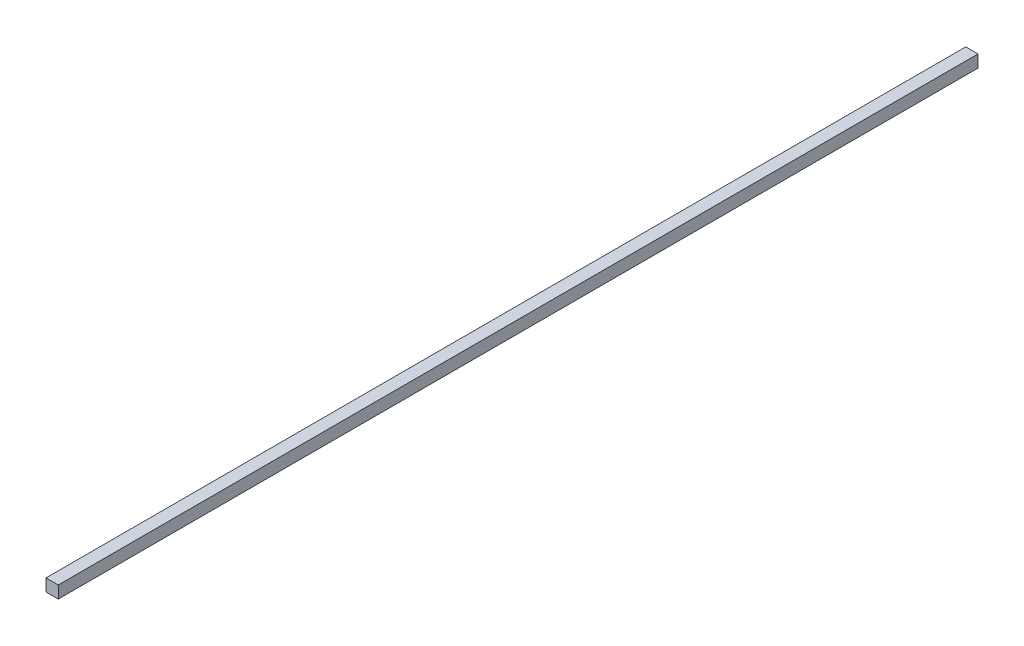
SolidWorks part; units mm, degrees
ref_plane "Plan de face" through (0, 0, 0) normal (0, 0, 1) x (1, 0, 0)
ref_plane "Plan de dessus" through (0, 0, 0) normal (0, 1, 0) x (1, 0, 0)
ref_plane "Plan de droite" through (0, 0, 0) normal (1, 0, 0) x (0, 0, -1)
sketch "Esquisse1" plane through (0, 0, 0) normal (0, 0, 1) x (1, 0, 0)
  line L1 (-1, 1) -> (1, 1)
  line L2 (-1, 1) -> (-1, -1)
  line L3 (-1, -1) -> (1, -1)
  line L4 (1, 1) -> (1, -1)
  point P4 (0, 1)
  point P5 (-1, 0)
  dimension "D1" = 2
  dimension "D2" = 2
extrude "Extrusion1" add sketch "Esquisse1" along normal mid plane 150
